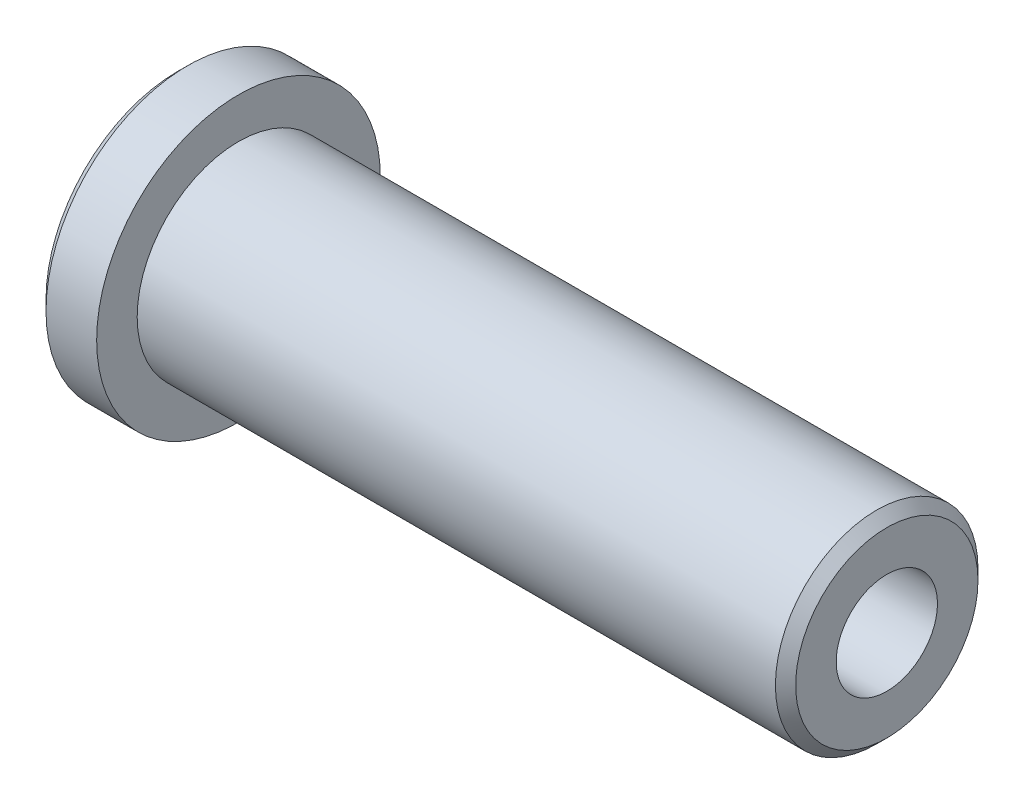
SolidWorks part; units mm, degrees
ref_plane "Face" through (0, 0, 0) normal (0, 0, 1) x (1, 0, 0)
ref_plane "Dessus" through (0, 0, 0) normal (0, 1, 0) x (1, 0, 0)
ref_plane "Droite" through (0, 0, 0) normal (1, 0, 0) x (0, 0, -1)
sketch "Esquisse1" plane through (0, 0, 0) normal (1, 0, 0) x (0, 0, -1)
  circle A0 centre (0, 0) radius 5
  dimension "D1" = 10
extrude "Base-Extrusion" add sketch "Esquisse1" along normal blind 32
sketch "Esquisse2" plane through (0, 0, 0) normal (1, 0, 0) x (0, 0, -1)
  circle A0 centre (0, 0) radius 7
  dimension "D1" = 14
extrude "Boss.-Extru.1" add sketch "Esquisse2" against normal blind 3
chamfer "Chanfrein1" distance 0.5 angle 45
sketch "Esquisse3" plane through (-3, 0, 0) normal (-1, 0, 0) x (0, 0, 1)
  line L0 (7.35, 0) -> (-7.35, 0) construction
  line L1 (1.4434, -2.5) -> (2.8868, 0)
  line L2 (2.8868, 0) -> (1.4434, 2.5)
  line L3 (1.4434, 2.5) -> (-1.4434, 2.5)
  line L4 (-1.4434, 2.5) -> (-2.8868, 0)
  line L5 (-2.8868, 0) -> (-1.4434, -2.5)
  line L6 (-1.4434, -2.5) -> (1.4434, -2.5)
  circle A0 centre (0, 0) radius 2.5 construction
  dimension "D1" = 5
extrude "Enlèv. mat.-Extru.1" cut sketch "Esquisse3" against normal blind 6
sketch "Esquisse4" plane through (32, 0, 0) normal (1, 0, 0) x (0, 0, -1)
  circle A0 centre (0, 0) radius 2.5
  dimension "D1" = 5
extrude "Enlèv. mat.-Extru.2" cut sketch "Esquisse4" against normal blind 22
